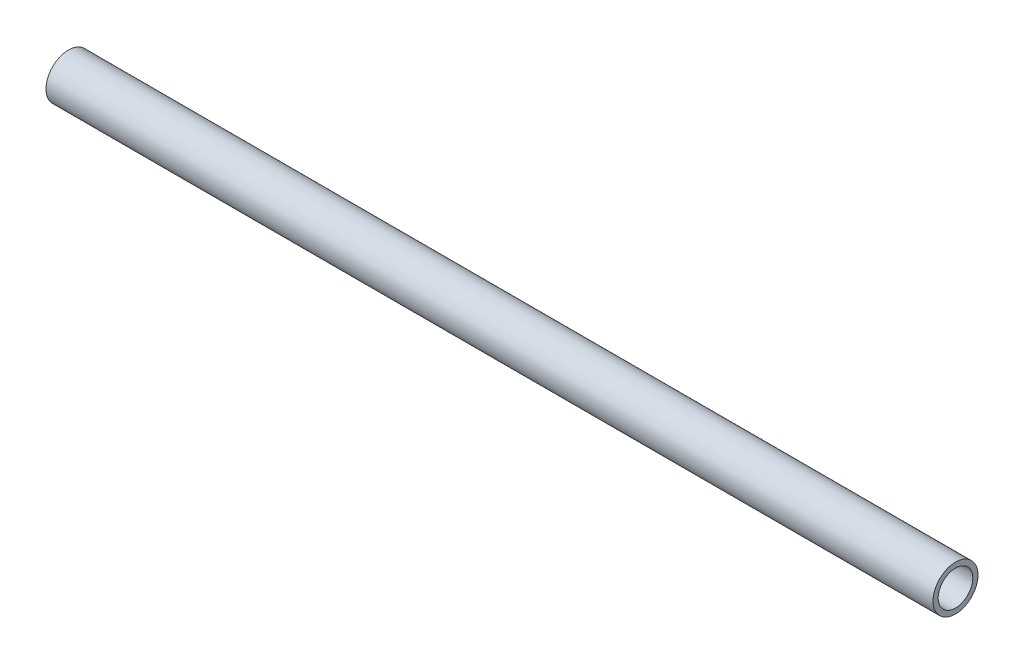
SolidWorks part; units mm, degrees
ref_plane "Front" through (0, 0, 0) normal (0, 0, 1) x (1, 0, 0)
ref_plane "Top" through (0, 0, 0) normal (0, 1, 0) x (1, 0, 0)
ref_plane "Right" through (0, 0, 0) normal (1, 0, 0) x (0, 0, -1)
sketch "Sketch1" plane through (0, 0, 0) normal (0, 0, 1) x (1, 0, 0)
  line L0 (0, 0) -> (650.875, 0)
  line L1 (9.9848, 0) -> (-9.9848, 0) construction
  dimension "D1" = 650.875
other "Structural Member1"
ref_plane "Plane1" through (0, 0, 0) normal (1, 0, 0) x (0, 0, -1)
sketch "Sketch11" plane through (0, 0, 0) normal (1, 0, 0) x (0, 0, -1)
  circle A0 centre (0, 0) radius 12.7
  circle A1 centre (0, 0) radius 16.51
  point P3 (0, 0)
  dimension "D1" = 33.02
  dimension "D2" = 25.4
